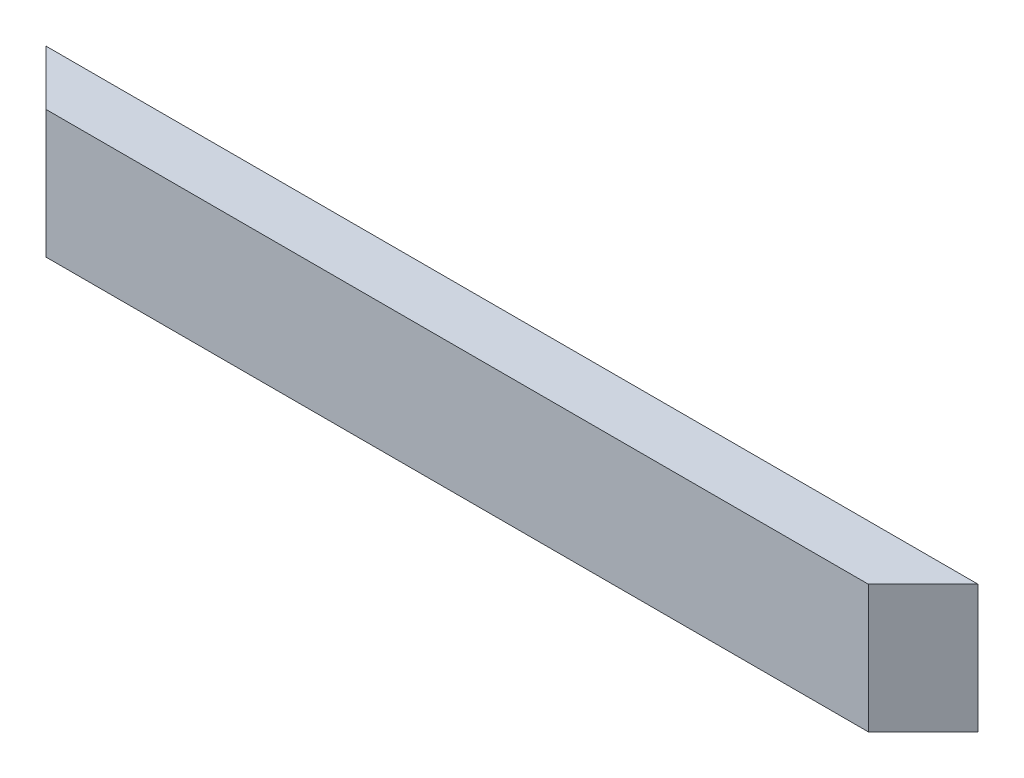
SolidWorks part; units mm, degrees
ref_plane "Front Plane" through (0, 0, 0) normal (0, 0, 1) x (1, 0, 0)
ref_plane "Top Plane" through (0, 0, 0) normal (0, 1, 0) x (1, 0, 0)
ref_plane "Right Plane" through (0, 0, 0) normal (1, 0, 0) x (0, 0, -1)
sketch "Sketch1" plane through (0, 0, 0) normal (0, 1, 0) x (1, 0, 0)
  line L0 (-304.8, 0) -> (304.8, 0) construction
  line L1 (-323.85, 19.05) -> (-285.75, -19.05)
  line L2 (-285.75, -19.05) -> (285.75, -19.05)
  line L3 (285.75, -19.05) -> (323.85, 19.05)
  line L4 (323.85, 19.05) -> (-323.85, 19.05)
  point P3 (0, 0)
  dimension "D1" = 609.6
  dimension "D2" = 45
  dimension "D3" = 45
  dimension "D4" = 38.1
extrude "Extrude1" add sketch "Sketch1" along normal blind 88.9
